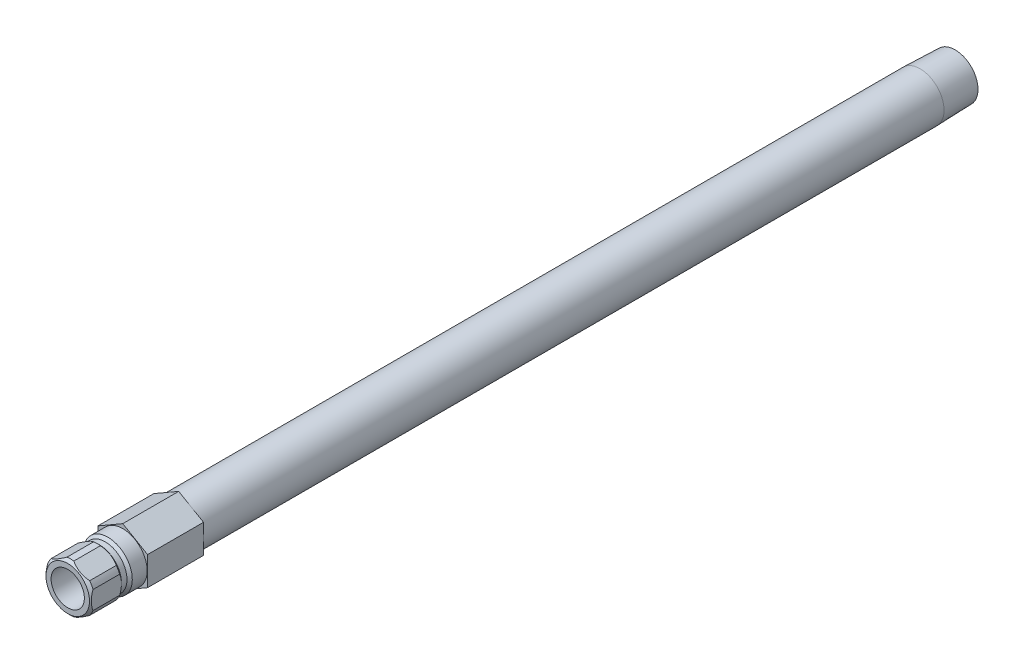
SolidWorks part; units mm, degrees
ref_plane "Front Plane" through (0, 0, 0) normal (0, 0, 1) x (1, 0, 0)
ref_plane "Top Plane" through (0, 0, 0) normal (0, 1, 0) x (1, 0, 0)
ref_plane "Right Plane" through (0, 0, 0) normal (1, 0, 0) x (0, 0, -1)
sketch "Sketch1" plane through (0, 0, 0) normal (1, 0, 0) x (0, 0, -1)
  line L0 (-12.8748, 0) -> (-18.923, 0) construction
  line L1 (-15.748, 4.7625) -> (-15.748, 6.223)
  line L2 (-6.604, 6.223) -> (-6.604, 0) construction
  line L3 (-14.986, 6.985) -> (-7.366, 6.985)
  line L4 (-3.556, 4.7625) -> (-3.556, 6.858) construction
  line L5 (-6.604, 6.223) -> (-5.0165, 6.223)
  line L6 (-4.2545, 6.985) -> (0, 6.985)
  line L7 (0, 6.985) -> (0, 6.858)
  line L8 (-6.604, 6.223) -> (-7.366, 6.985)
  line L9 (-5.0165, 6.223) -> (-4.2545, 6.985)
  line L10 (-15.748, 6.223) -> (-14.986, 6.985)
  line L11 (-15.748, 4.7625) -> (-3.556, 4.7625)
  line L12 (0, 6.858) -> (228.219, 6.858)
  line L13 (228.219, 6.858) -> (238.252, 6.5445)
  line L14 (238.252, 6.5445) -> (238.252, 4.6228)
  line L15 (-3.556, 4.7625) -> (-3.4817, 4.6228)
  line L16 (16.002, 6.858) -> (16.002, 0) construction
  line L17 (16.002, 0) -> (-12.8748, 0) construction
  line L19 (-3.4817, 4.6228) -> (238.252, 4.6228)
  dimension "D1" = 15.748
  dimension "D2" = 1.5875
  dimension "D3" = 0.762
  dimension "D4" = 45
  dimension "D5" = 9.144
  dimension "D6" = 45
  dimension "D7" = 1.79
  dimension "D8" = 10.033
  dimension "D9" = 254
  dimension "D10" = 3.175
  dimension "D11" = 9.525
  dimension "D12" = 13.716
  dimension "D13" = 31.75
  dimension "D14" = 13.97
  dimension "D15" = 9.2456
  dimension "D17" = 118
  dimension "D18" = 12.192
revolve "Revolve1" add sketch "Sketch1" angle 360 about L0
sketch "Sketch2" plane through (0, 0, 0) normal (0, 0, 1) x (1, 0, 0)
  line L1 (-7.112, 4.1061) -> (-7.112, -4.1061)
  line L2 (-7.112, -4.1061) -> (0, -8.2122)
  line L3 (0, -8.2122) -> (7.112, -4.1061)
  line L4 (7.112, -4.1061) -> (7.112, 4.1061)
  line L5 (7.112, 4.1061) -> (0, 8.2122)
  line L6 (0, 8.2122) -> (-7.112, 4.1061)
  circle A0 centre (0, 0) radius 7.112 construction
  circle A1 centre (0, 0) radius 4.6228 construction
  circle A2 centre (0, 0) radius 4.6228
  dimension "D1" = 14.224
extrude "Boss-Extrude1" add sketch "Sketch2" against normal up to vertex (16.002 mm away)
sketch "Sketch3" plane through (0, 0, 0) normal (0, 0, 1) x (1, 0, 0)
  line L1 (6.477, -3.7395) -> (6.477, 3.7395)
  line L2 (6.477, 3.7395) -> (0, 7.479)
  line L3 (0, 7.479) -> (-6.477, 3.7395)
  line L4 (-6.477, 3.7395) -> (-6.477, -3.7395)
  line L5 (-6.477, -3.7395) -> (0, -7.479)
  line L6 (0, -7.479) -> (6.477, -3.7395)
  circle A0 centre (0, 0) radius 6.477 construction
  dimension "D1" = 12.954
extrude "Cut-Extrude1" cut sketch "Sketch3" along normal through all from vertex at 6.604 flip side to cut
